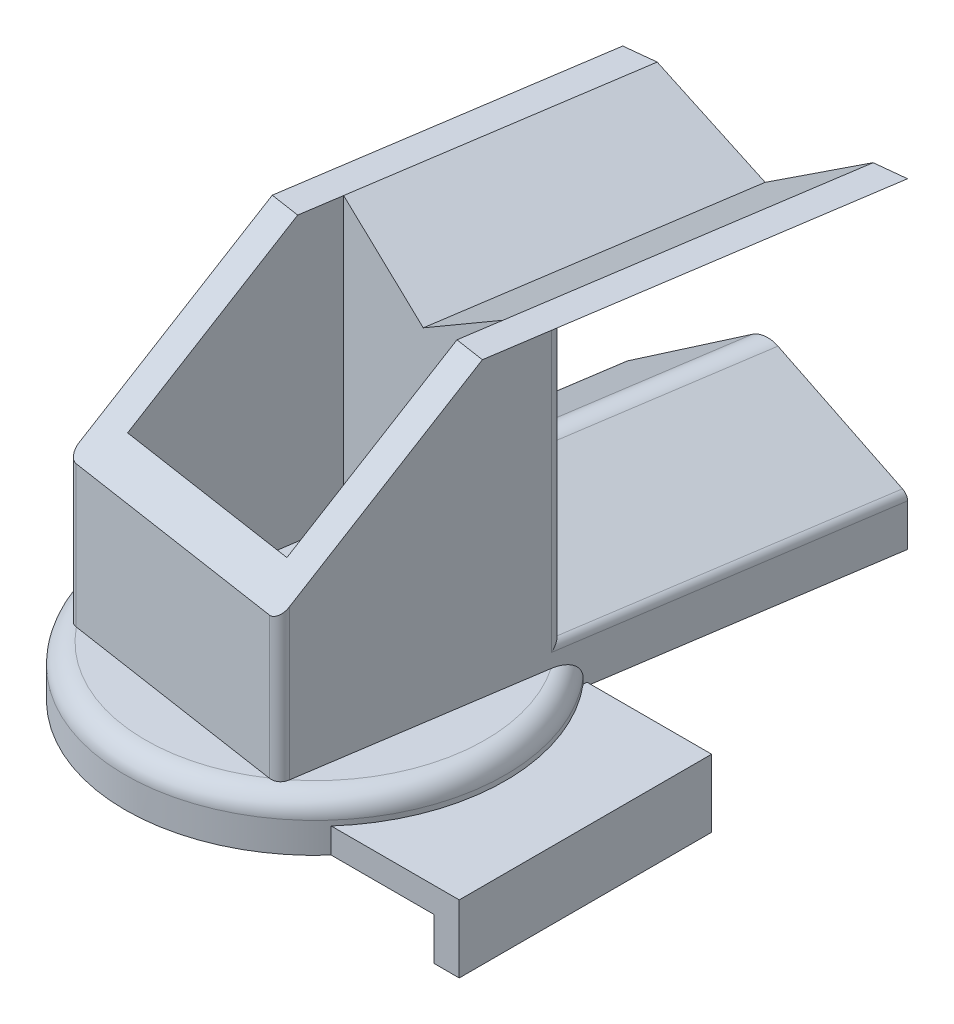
SolidWorks part; units mm, degrees
ref_plane "Front Plane" through (0, 0, 0) normal (0, 0, 1) x (1, 0, 0)
ref_plane "Top Plane" through (0, 0, 0) normal (0, 1, 0) x (1, 0, 0)
ref_plane "Right Plane" through (0, 0, 0) normal (1, 0, 0) x (0, 0, -1)
sketch "Sketch1" plane through (0, 0, 0) normal (0, 1, 0) x (1, 0, 0)
  circle A0 centre (0, 0) radius 6.1
  circle A1 centre (0, 0) radius 3.4
extrude "Boss-Extrude1" add sketch "Sketch1" along normal blind 3.7
sketch "Sketch2" plane through (0, 3.7, 0) normal (0, 1, 0) x (1, 0, 0)
  circle A0 centre (0, 0) radius 18.83
extrude "Boss-Extrude2" add sketch "Sketch2" along normal blind 5
sketch "Sketch5" plane through (0, 3.7, 0) normal (0, -1, 0) x (-1, 0, 0)
  line L0 (0, 0) -> (-21.3385, 0) construction
  line L2 (-10.7614, 12.5) -> (-26.7614, 12.5)
  line L3 (-10.7614, 12.5) -> (-10.7614, -12.5)
  line L4 (-10.7614, -12.5) -> (-26.7614, -12.5)
  line L5 (-26.7614, 12.5) -> (-26.7614, -12.5)
  line L6 (-10.7614, 12.5) -> (-26.7614, -12.5) construction
  line L7 (-10.7614, -12.5) -> (-26.7614, 12.5) construction
  point P3 (-18.7614, 0)
  dimension "D1" = 25
  dimension "D2" = 8
extrude "Boss-Extrude3" add sketch "Sketch5" against normal blind 2.5
sketch "Sketch6" plane through (0, 3.7, 0) normal (0, -1, 0) x (1, 0, 0)
  line L0 (14.0826, -12.5) -> (26.7614, -12.5) construction
  line L1 (26.7614, 12.5) -> (24.2614, 12.5)
  line L2 (26.7614, 12.5) -> (26.7614, -12.5)
  line L3 (26.7614, -12.5) -> (24.2614, -12.5)
  line L4 (24.2614, 12.5) -> (24.2614, -12.5)
  dimension "D1" = 2.5
extrude "Boss-Extrude4" add sketch "Sketch6" along normal blind 4.2
sketch "Sketch7" plane through (0, 8.7, 0) normal (0, 1, 0) x (1, 0, 0)
  line L0 (0, 0) -> (-6.288, -20.3133) construction
  line L1 (-10.4063, 14.1148) -> (14.1148, 10.4063)
  line L2 (-10.4063, 14.1148) -> (-14.1148, -10.4063)
  line L3 (-14.1148, -10.4063) -> (10.4063, -14.1148)
  line L4 (14.1148, 10.4063) -> (10.4063, -14.1148)
  line L5 (-10.4063, 14.1148) -> (10.4063, -14.1148) construction
  line L6 (-14.1148, -10.4063) -> (14.1148, 10.4063) construction
  point P0 (0, 0)
  dimension "D1" = 24.8
  dimension "D2" = 24.8
  dimension "D3" = 8.6
  dimension "D5" = 12.4
  dimension "D6" = 12.4
extrude "Boss-Extrude5" add sketch "Sketch7" along normal blind 29
sketch "Sketch8" plane through (0, 37.7, 0) normal (0, 1, 0) x (1, 0, 0)
  line L0 (14.1148, 10.4063) -> (-10.4063, 14.1148) construction
  line L1 (-7.8887, 10.6999) -> (10.6999, 7.8887)
  line L2 (-7.8887, 10.6999) -> (-10.6999, -7.8887)
  line L3 (-10.6999, -7.8887) -> (7.8887, -10.6999)
  line L4 (10.6999, 7.8887) -> (7.8887, -10.6999)
  line L5 (-7.8887, 10.6999) -> (7.8887, -10.6999) construction
  line L6 (-10.6999, -7.8887) -> (10.6999, 7.8887) construction
  line L7 (-14.1148, -10.4063) -> (10.4063, -14.1148) construction
  line L8 (-10.4063, 14.1148) -> (-14.1148, -10.4063) construction
  line L9 (10.4063, -14.1148) -> (14.1148, 10.4063) construction
  point P0 (0, 0)
  dimension "D1" = 3
  dimension "D2" = 3
  dimension "D3" = 3
  dimension "D4" = 3
extrude "Cut-Extrude1" cut sketch "Sketch8" against normal blind 28
sketch "Sketch9" plane through (0, 3.7, 0) normal (0, -1, 0) x (1, 0, 0)
  circle A0 centre (0, 0) radius 3.4
extrude "Cut-Extrude2" cut sketch "Sketch9" against normal through all
sketch "Sketch10" plane through (1.8542, 0, -12.2606) normal (0.1495, 0, -0.9888) x (-0.9888, 0, -0.1495)
  line L0 (12.4, 37.7) -> (12.4, 8.7) construction
  line L1 (-12.4, 37.7) -> (12.4, 37.7)
  line L2 (-12.4, 37.7) -> (-12.4, 28.7)
  line L3 (-12.4, 28.7) -> (12.4, 28.7)
  line L4 (12.4, 37.7) -> (12.4, 28.7)
  line L5 (-12.4, 37.7) -> (-12.4, 8.7) construction
  line L6 (-12.4, 18.9) -> (12.4, 18.9)
  line L7 (-12.4, 18.9) -> (-12.4, 5.9)
  line L8 (-12.4, 5.9) -> (12.4, 5.9)
  line L9 (12.4, 18.9) -> (12.4, 5.9)
  dimension "D1" = 9
  dimension "D2" = 13
  dimension "D3" = 9.8
extrude "Boss-Extrude6" add sketch "Sketch10" along normal blind 30
sketch "Sketch11" plane through (6.3403, 0, -41.9233) normal (0.1495, 0, -0.9888) x (-0.9888, 0, -0.1495)
  line L0 (0, 0) -> (0, 42.4361) construction
  line L1 (0, 31.7) -> (12.8009, 31.7) construction
  line L2 (-12.4, 28.7) -> (12.4, 28.7) construction
  line L3 (0, 31.7) -> (-9.4, 37.7)
  line L4 (12.4, 37.7) -> (-12.4, 37.7) construction
  line L5 (-9.4, 37.7) -> (9.4, 37.7)
  line L6 (9.4, 37.7) -> (0, 31.7)
  dimension "D1" = 3
  dimension "D2" = 3
  dimension "D3" = 3
extrude "Cut-Extrude3" cut sketch "Sketch11" against normal through all
sketch "Sketch13" plane through (6.3403, 0, -41.9233) normal (0.1495, 0, -0.9888) x (-0.9888, 0, -0.1495)
  line L0 (0, 28.7) -> (12.4, 28.7)
  line L1 (0, 28.7) -> (12.4, 37.7)
  line L2 (-12.4, 28.7) -> (12.4, 28.7) construction
  line L3 (12.4, 37.7) -> (12.4, 28.7)
extrude "Cut-Extrude4" cut sketch "Sketch13" against normal blind 30
sketch "Sketch15" plane through (6.3403, 0, -41.9233) normal (0.1495, 0, -0.9888) x (-0.9888, 0, -0.1495)
  line L0 (-12.4, 37.7) -> (0, 28.7)
  line L1 (0, 28.7) -> (-12.4, 28.7)
  line L2 (-12.4, 28.7) -> (-12.4, 37.7)
extrude "Cut-Extrude5" cut sketch "Sketch15" against normal blind 30
sketch "Sketch16" plane through (6.3403, 0, -41.9233) normal (0.1495, 0, -0.9888) x (-0.9888, 0, -0.1495)
  line L0 (12.4, 18.9) -> (12.4, 10.6)
  line L1 (12.4, 18.9) -> (-12.4, 18.9) construction
  line L2 (0, 18.9) -> (12.4, 18.9)
  line L3 (12.4, 10.6) -> (0, 18.9)
  line L5 (12.4, 5.9) -> (12.4, 18.9) construction
  dimension "D1" = 8.3
extrude "Cut-Extrude8" cut sketch "Sketch16" against normal blind 30
sketch "Sketch17" plane through (6.3403, 0, -41.9233) normal (0.1495, 0, -0.9888) x (-0.9888, 0, -0.1495)
  line L1 (-12.4, 18.9) -> (-12.4, 5.9) construction
  line L2 (-12.4, 10.6) -> (-12.4, 18.9)
  line L3 (-12.4, 18.9) -> (0, 18.9)
  line L6 (-12.4, 10.6) -> (0, 18.9)
  dimension "D1" = 8.3
extrude "Cut-Extrude9" cut sketch "Sketch17" against normal blind 30
sketch "Sketch18" plane through (6.3403, 0, -41.9233) normal (0.1495, 0, -0.9888) x (-0.9888, 0, -0.1495)
  line L0 (0, 22.5727) -> (0, -2.6452) construction
  line L1 (0, 15.9) -> (9.4, 9.4)
  line L2 (9.4, 9.4) -> (9.4, 5.9)
  line L3 (-12.055, 5.9) -> (12.4, 5.9) construction
  line L4 (9.4, 5.9) -> (-9.4, 5.9)
  line L5 (-9.4, 5.9) -> (-9.4, 9.4)
  line L6 (-9.4, 9.4) -> (0, 15.9)
  line L7 (-12.4, 10.6) -> (-12.4, 5.9) construction
  dimension "D1" = 3
  dimension "D2" = 3
  dimension "D3" = 3
  dimension "D4" = 3.5
  dimension "D5" = 3.5
extrude "Cut-Extrude10" cut sketch "Sketch18" against normal blind 25
sketch "Sketch19" plane through (-12.2606, 0, -1.8542) normal (-0.9888, 0, -0.1495) x (-0.1495, 0, 0.9888)
  line L0 (12.4, 22.7) -> (-5.4, 37.7)
  line L1 (12.4, 37.7) -> (12.4, 8.7) construction
  line L2 (-12.4, 37.7) -> (12.4, 37.7) construction
  line L3 (-5.4, 37.7) -> (12.4, 37.7)
  line L4 (12.4, 37.7) -> (12.4, 22.7)
  dimension "D1" = 14
  dimension "D2" = 7
extrude "Cut-Extrude11" cut sketch "Sketch19" against normal through all
fillet "Fillet3" radius 2 1 edges at (-2.8158, 8.7, 18.6183)
sketch "Sketch20" plane through (0, 0, 0) normal (0, -1, 0) x (1, 0, 0)
  circle A0 centre (0, 0) radius 4.25
extrude "Cut-Extrude12" cut sketch "Sketch20" against normal blind 3
sketch "Sketch21" plane through (0, 37.7, 0) normal (0, 1, 0) x (1, 0, 0)
  line L0 (-6.8923, 37.3506) -> (-5.9203, 43.7775)
  line L1 (-5.9203, 43.7775) -> (-10.4063, 14.1148) construction
  line L2 (-5.9203, 43.7775) -> (18.6009, 40.069)
  line L3 (18.6009, 40.069) -> (-6.8923, 37.3506)
  dimension "D1" = 30.5
extrude "Cut-Extrude13" cut sketch "Sketch21" against normal through all
fillet "Fillet4" radius 2 2 edges at (3.8543, 28.7, -25.4852) (3.8543, 18.9, -25.4852)
fillet "Fillet5" radius 1 4 edges at (-14.1148, 15.6356, 10.4063) (-10.4063, 24.15, -14.1148) (14.1148, 24.15, -10.4063) (10.4063, 15.6356, 14.1148)
fillet "Fillet6" radius 1 2 edges at (-8.7241, 10.6, -25.2383) (16.2831, 10.6, -24.7433)
